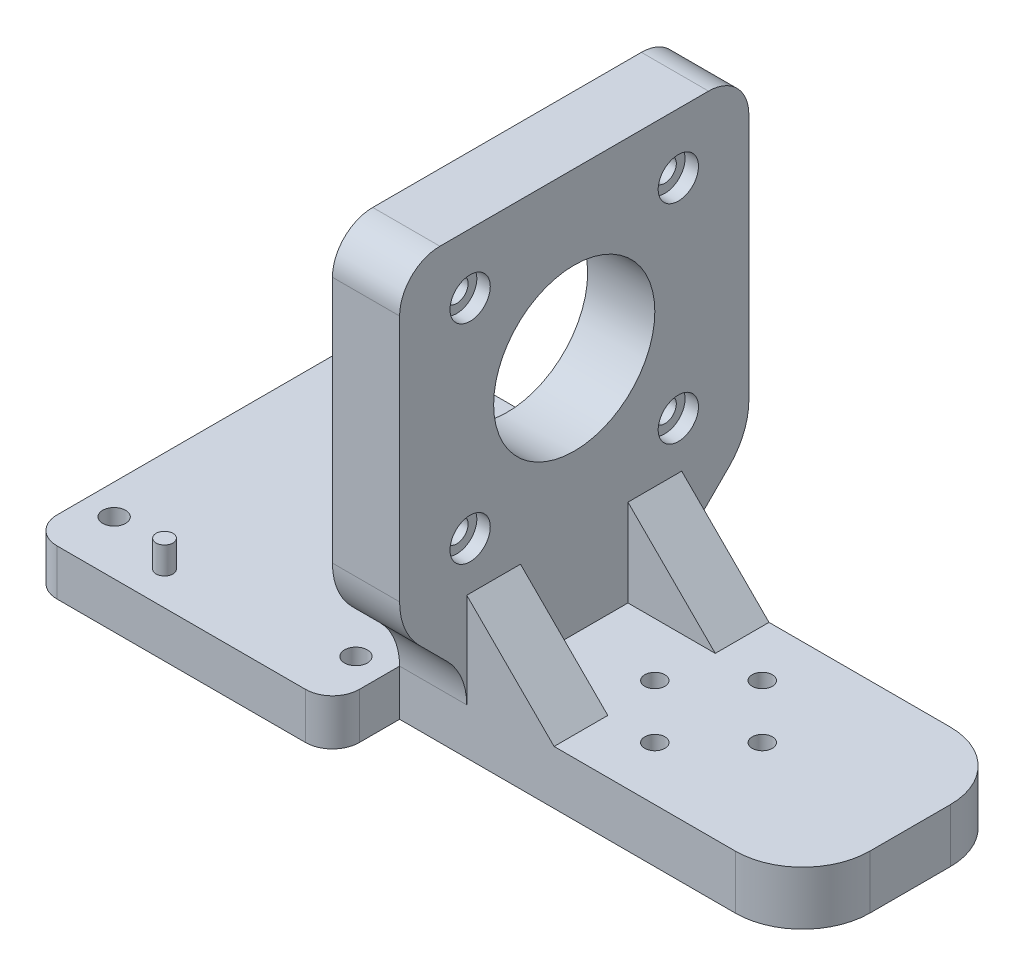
SolidWorks part; units mm, degrees
ref_plane "前视基准面" through (0, 0, 0) normal (0, 0, 1) x (1, 0, 0)
ref_plane "上视基准面" through (0, 0, 0) normal (0, 1, 0) x (1, 0, 0)
ref_plane "右视基准面" through (0, 0, 0) normal (1, 0, 0) x (0, 0, -1)
sketch "草图2" plane through (0, 0, 0) normal (0, 1, 0) x (1, 0, 0)
  line L0 (0, 16) -> (0, -16) construction
  line L1 (-30, 16) -> (30, 16)
  line L2 (-30, 16) -> (-30, -16)
  line L3 (-30, -16) -> (30, -16)
  line L4 (30, 16) -> (30, -16)
  line L5 (-30, 16) -> (30, -16) construction
  line L6 (-30, -16) -> (30, 16) construction
  line L7 (-8, 0) -> (30, 0) construction
  circle A0 centre (0, 0) radius 8 construction
  circle A1 centre (0, 8) radius 1.5
  circle A2 centre (8, 0) radius 1.5
  circle A3 centre (0, -8) radius 1.5
  circle A4 centre (-8, 0) radius 1.5
  point P0 (0, 0)
  point P23 (0, 0)
  dimension "D4" = 16
  dimension "D5" = 3
  dimension "D6" = 4
  dimension "D1" = 30
  dimension "D2" = 60
  dimension "D3" = 32
extrude "凸台-拉伸2" add sketch "草图2" against normal blind 8
sketch "草图4" plane through (0, 0, 0) normal (0, 1, 0) x (1, 0, 0)
  line L0 (-30, 16) -> (-30, -16)
  line L1 (30, 16) -> (-30, 16) construction
  line L2 (-30, 16) -> (-30, -16) construction
  line L3 (-20, 16) -> (-20, -16)
  line L4 (-30, 16) -> (-20, 16)
  line L5 (-30, -16) -> (-20, -16)
  dimension "D1" = 10
extrude "凸台-拉伸3" add sketch "草图4" along normal blind 60
sketch "草图6" plane through (0, 0, 16) normal (0, 0, 1) x (1, 0, 0)
  line L0 (-20, 13) -> (-7, 0)
  line L1 (-20, 60) -> (-20, 0) construction
  line L2 (-20, 0) -> (30, 0) construction
  line L3 (-20, 13) -> (-20, 0) construction
  line L4 (-20, 0) -> (-7, 0) construction
  dimension "D1" = 13
  dimension "D2" = 13
rib "筋1" sketch "草图6" sketch "草图6" thickness 8 extrusion direction parallel to sketch draft on no parameters "D1"=8
mirror "镜向1" about plane through (0, 0, 0) normal (0, 0, 1) of "筋1"
fillet "圆角2" radius 10 1 edges at (30, -4, 16)
fillet "圆角3" radius 10 1 edges at (30, -4, -16)
sketch "草图7" plane through (-20, 0, 0) normal (1, 0, 0) x (0, 0, -1)
  line L0 (-16, 60) -> (16, 60)
sketch "草图9" plane through (0, 0, 16) normal (0, 0, 1) x (1, 0, 0)
  line L0 (-20, 13) -> (-30, 13)
  line L1 (-30, -8) -> (-30, 60) construction
  line L2 (-30, 13) -> (-30, 60)
  line L3 (-30, 60) -> (-20, 60)
  line L4 (-20, 60) -> (-20, 13)
extrude "凸台-拉伸4" add sketch "草图9" along normal blind 10
mirror "镜向2" about plane through (0, 0, 0) normal (0, 0, 1) of "凸台-拉伸4"
sketch "草图10" plane through (-30, 0, 0) normal (-1, 0, 0) x (0, 0, 1)
  line L0 (-26, 13) -> (-16, 3)
  line L1 (-16, -8) -> (-16, 13) construction
  line L2 (-16, 13) -> (-26, 13)
  line L3 (-16, 3) -> (-16, 13)
  dimension "D1" = 10
extrude "凸台-拉伸5" add sketch "草图10" against normal blind 10
mirror "镜向3" about plane through (0, 0, 0) normal (0, 0, 1) of "凸台-拉伸5"
fillet "圆角5" radius 10 1 edges at (-25, 3, 16)
fillet "圆角6" radius 10 1 edges at (-25, 3, -16)
fillet "圆角7" radius 10 2 edges at (-25, 13, -26) (-25, 13, 26)
fillet "圆角8" radius 6 2 edges at (-25, 60, 26) (-25, 60, -26)
sketch "草图11" plane through (-20, 0, 0) normal (1, 0, 0) x (0, 0, -1)
  line L0 (-26, 54) -> (26, 17.1421) construction
  line L1 (26, 54) -> (-26, 17.1421) construction
  circle A0 centre (0, 35.5711) radius 12
  dimension "D1" = 24
extrude "切除-拉伸1" cut sketch "草图11" against normal through all and the other way through all
sketch "草图13" plane through (-20, 0, 0) normal (1, 0, 0) x (0, 0, -1)
  line L0 (-26, 54) -> (26, 17.1421) construction
  line L1 (26, 54) -> (-26, 17.1421) construction
  line L3 (-15.5, 51.0711) -> (15.5, 51.0711)
  line L4 (-15.5, 51.0711) -> (-15.5, 20.0711)
  line L5 (-15.5, 20.0711) -> (15.5, 20.0711)
  line L6 (15.5, 51.0711) -> (15.5, 20.0711)
  line L7 (-15.5, 51.0711) -> (15.5, 20.0711) construction
  line L8 (-15.5, 20.0711) -> (15.5, 51.0711) construction
  point P8 (0, 35.5711)
  dimension "D1" = 31
  dimension "D2" = 31
sketch "草图14" plane through (-20, 0, 0) normal (1, 0, 0) x (0, 0, -1)
  point P0 (-15.5, 51.0711)
  point P3 (15.5, 51.0711)
  point P6 (15.5, 20.0711)
  point P9 (-15.5, 20.0711)
hole_wizard "M3 六角圆柱头螺钉的柱形沉头孔1" positions "草图14" profile "草图16" counterbore size "M3" standard "GB"
sketch "草图16" plane through (-20, 51.0711, 15.5) normal (0, 1, 0) x (0, 0, -1)
  line L0 (0, 0) -> (0, 10)
  line L1 (0, 10) -> (1.7, 10)
  line L3 (1.7, 10) -> (1.7, 2)
  line L4 (1.7, 2) -> (3, 2)
  line L5 (3, 2) -> (3, 0)
  line L7 (3, 0) -> (0, 0)
  line L11 (0, -6.35) -> (0, 107.95) construction
  dimension "通孔孔直径" = 3.4
  dimension "通孔孔深度" = 10
  dimension "柱形沉头孔直径" = 6
  dimension "柱形沉头孔深度" = 2
sketch "草图17" plane through (-30, 0, 0) normal (-1, 0, 0) x (0, 0, 1)
  line L0 (-16, -1.1421) -> (16, -1.1421)
  line L1 (16, -1.1421) -> (16, -8)
  line L2 (-16, -8) -> (16, -8)
  line L3 (-16, -1.1421) -> (-16, -8)
extrude "凸台-拉伸6" add sketch "草图17" along normal blind 45
sketch "草图18" plane through (0, -1.1421, 0) normal (0, 1, 0) x (1, 0, 0)
  line L0 (-75, 16) -> (-30, 16)
  line L1 (-75, -16) -> (-30, -16)
  line L2 (-75, 26) -> (-30, 26)
  line L3 (-75, -26) -> (-30, -26)
  line L4 (-75, 26) -> (-75, -26)
  line L5 (-30, 26) -> (-30, -26)
  dimension "D1" = 10
  dimension "D2" = 10
extrude "凸台-拉伸9" add sketch "草图18" against normal up to vertex (6.8579 mm away) contours L4 L3 L5 L2
fillet "圆角9" radius 4 4 edges at (-30, -4.5711, -26) (-75, -4.5711, -26) (-75, -4.5711, 26) (-30, -4.5711, 26)
sketch "草图21" plane through (0, -1.1421, 0) normal (0, 1, 0) x (1, 0, 0)
  line L0 (-75, 22) -> (-30, -22) construction
  line L1 (-30, -16) -> (-30, -22) construction
  line L2 (-75, -22) -> (-30, 22) construction
  line L4 (-70.5, 18) -> (-34.5, 18)
  line L5 (-70.5, 18) -> (-70.5, -18)
  line L6 (-70.5, -18) -> (-34.5, -18)
  line L7 (-34.5, 18) -> (-34.5, -18)
  line L8 (-70.5, 18) -> (-34.5, -18) construction
  line L9 (-70.5, -18) -> (-34.5, 18) construction
  arc A0 (-34, -26) -> (-30, -22) centre (-34, -22) ccw construction
  point P12 (-52.5, 0)
  dimension "D1" = 36
  dimension "D2" = 36
sketch "草图22" plane through (0, -1.1421, 0) normal (0, 1, 0) x (1, 0, 0)
  line L0 (-52.5, 0) -> (-52.5, 35.7775) construction
  line L1 (-52.5, 0) -> (-94.6568, 0) construction
  circle A0 centre (-70.5, 18) radius 1.7
  circle A1 centre (-34.5, 18) radius 1.7
  circle A2 centre (-34.5, -18) radius 1.7
  circle A3 centre (-70.5, -18) radius 1.7
  dimension "D1" = 3.4
extrude "切除-拉伸2" cut sketch "草图22" against normal blind 7
sketch "草图23" plane through (0, -1.1421, 0) normal (0, 1, 0) x (1, 0, 0)
  line L0 (-71, -26) -> (-34, -26) construction
  line L1 (-75, -22) -> (-75, 22) construction
  circle A0 centre (-60, -21) radius 1.25
  dimension "D1" = 2.5
  dimension "D2" = 5
  dimension "D3" = 15
extrude "凸台-拉伸10" add sketch "草图23" along normal blind 4
sketch "草图24" plane through (0, 0, 0) normal (0, 0, 1) x (1, 0, 0)
  line L0 (-30, 10.0711) -> (-41.2132, -1.1421)
  line L1 (-70.5, -1.1421) -> (-34.5, -1.1421) construction
  line L2 (-20, -1.1421) -> (-30, -1.1421) construction
  line L3 (-41.2132, -1.1421) -> (-30, -1.1421)
  line L4 (-30, -1.1421) -> (-30, 10.0711)
  dimension "D1" = 45
extrude "凸台-拉伸11" add sketch "草图24" along normal mid plane 14
